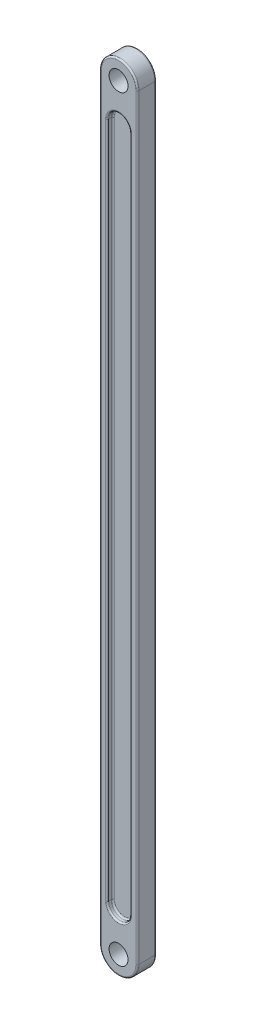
SolidWorks part; units mm, degrees
ref_plane "Front Plane" through (0, 0, 0) normal (0, 0, 1) x (1, 0, 0)
ref_plane "Top Plane" through (0, 0, 0) normal (0, 1, 0) x (1, 0, 0)
ref_plane "Right Plane" through (0, 0, 0) normal (1, 0, 0) x (0, 0, -1)
sketch "Sketch1" plane through (0, 0, 0) normal (0, 0, 1) x (1, 0, 0)
  line L0 (0, 1000) -> (0, 0) construction
  line L1 (25, 1000) -> (25, 0)
  line L2 (-25, 1000) -> (-25, 0)
  arc A0 (25, 1000) -> (-25, 1000) centre (0, 1000) ccw
  arc A1 (-25, 0) -> (25, 0) centre (0, 0) ccw
  circle A2 centre (0, 0) radius 12.5
  circle A3 centre (0, 1000) radius 12.5
  dimension "D2" = 25
  dimension "D3" = 25
  dimension "D1" = 1000
extrude "Extrude1" add sketch "Sketch1" along normal mid plane 25
fillet "Fillet1" radius 2 8 edges at (0, 1025, 12.5) (25, 500, 12.5) (0, -25, 12.5) (0, 1025, -12.5) (25, 500, -12.5) (0, -25, -12.5) (-25, 500, 12.5) (-25, 500, -12.5)
sketch "Sketch2" plane through (0, 0, -12.5) normal (0, 0, -1) x (-1, 0, 0)
  line L0 (0, 1000) -> (0, 0) construction
  line L2 (25, 1000) -> (25, 0) construction
  line L3 (0, 947.5) -> (0, 52.5) construction
  line L4 (15, 947.5) -> (15, 52.5)
  line L5 (-15, 947.5) -> (-15, 52.5)
  circle A0 centre (0, 0) radius 12.5 construction
  arc A4 (15, 947.5) -> (-15, 947.5) centre (0, 947.5) ccw
  arc A5 (-15, 52.5) -> (15, 52.5) centre (0, 52.5) ccw
  point P11 (0, 500)
  dimension "D2" = 25
  dimension "D1" = 10
extrude "Extrude2" cut sketch "Sketch2" against normal blind 15 from offset 7.5 contours L5 A5 L4 A4
mirror "Mirror1" about plane through (0, 0, 0) normal (0, 0, 1) of "Extrude2"
fillet "Fillet2" radius 2 16 edges at (0, 962.5, 5) (-15, 500, 5) (0, 37.5, 5) (0, 962.5, 12.5) (-15, 500, 12.5) (0, 37.5, 12.5) (0, 962.5, -5) (-15, 500, -5) (0, 37.5, -5) (0, 37.5, -12.5) (-15, 500, -12.5) (0, 962.5, -12.5) (15, 500, 5) (15, 500, 12.5) (15, 500, -5) (15, 500, -12.5)
